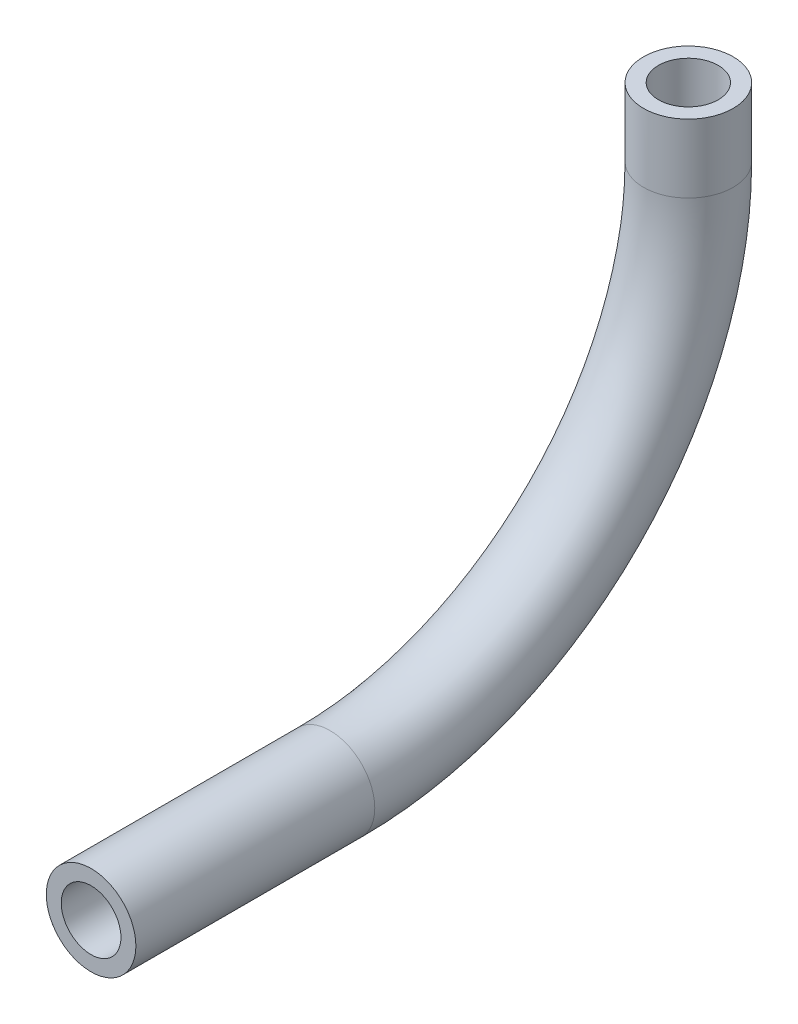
SolidWorks part; units mm, degrees
ref_plane "Front Plane" through (0, 0, 0) normal (0, 0, 1) x (1, 0, 0)
ref_plane "Top Plane" through (0, 0, 0) normal (0, 1, 0) x (1, 0, 0)
ref_plane "Right Plane" through (0, 0, 0) normal (1, 0, 0) x (0, 0, -1)
sketch "Sketch1" plane through (0, 0, 0) normal (0, 0, 1) x (1, 0, 0)
  circle A0 centre (0, 0) radius 9.525
  circle A1 centre (0, 0) radius 6.35
  dimension "D1" = 3.175
  dimension "D2" = 19.05
sketch "Sketch2" plane through (0, 0, 0) normal (1, 0, 0) x (0, 0, -1)
  line L0 (0, 0) -> (50.8, 0)
  line L1 (127, 76.2) -> (127, 90.7404)
  line L4 (194.8793, 128.8404) -> (-741.0419, 128.8404) construction
  arc A0 (50.8, 0) -> (127, 76.2) centre (50.8, 76.2) ccw
  point P6 (127, 0)
  dimension "D3" = 76.2
  dimension "D1" = 50.8
  dimension "D2" = 38.1
  dimension "D5" = 38.1
sweep "Sweep1" add profiles "Sketch1" path "Sketch2"
